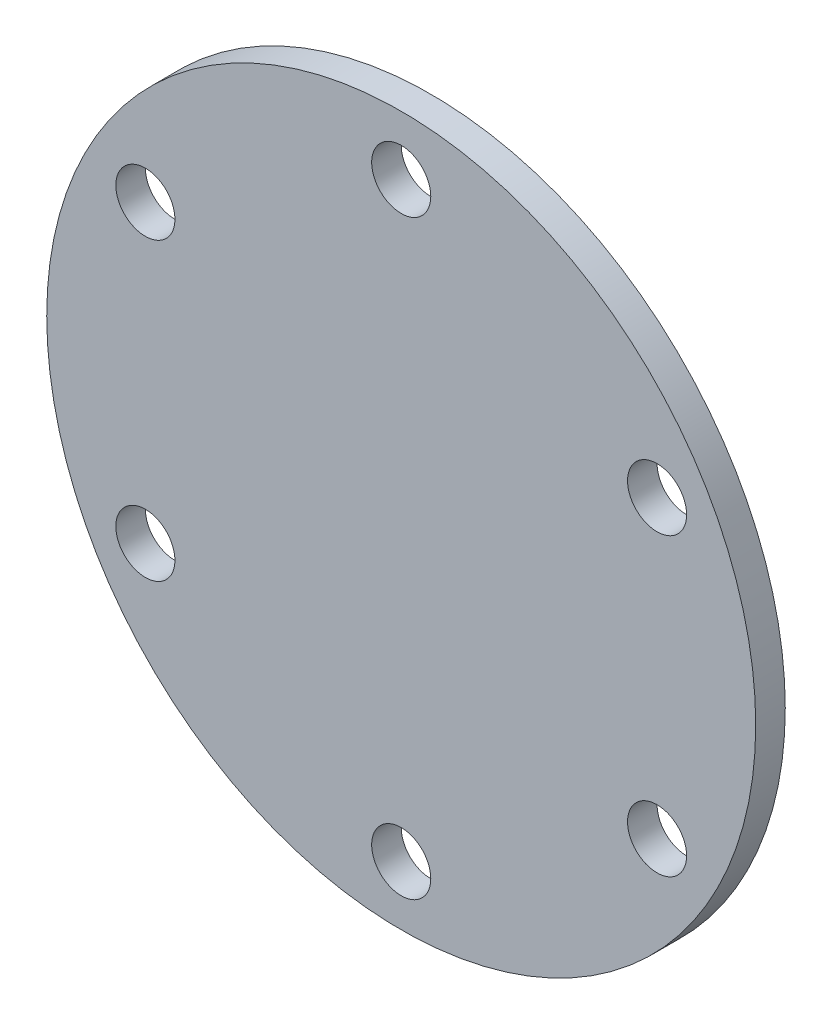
SolidWorks part; units mm, degrees
ref_plane "Front" through (0, 0, 0) normal (0, 0, 1) x (1, 0, 0)
ref_plane "Top" through (0, 0, 0) normal (0, 1, 0) x (1, 0, 0)
ref_plane "Right" through (0, 0, 0) normal (1, 0, 0) x (0, 0, -1)
sketch "Sketch1" plane through (0, 0, 0) normal (0, 0, 1) x (1, 0, 0)
  circle A0 centre (0, 0) radius 60
  circle A1 centre (0, 0) radius 50 construction
  circle A2 centre (0, 50) radius 5
  circle A3 centre (43.3013, 25) radius 5
  circle A4 centre (43.3013, -25) radius 5
  circle A5 centre (0, -50) radius 5
  circle A6 centre (-43.3013, -25) radius 5
  circle A7 centre (-43.3013, 25) radius 5
  point P19 (0, 0)
  dimension "D1" = 120
  dimension "D2" = 100
  dimension "D3" = 10
  dimension "D4" = 6
extrude "Boss-Extrude1" add sketch "Sketch1" along normal blind 5
